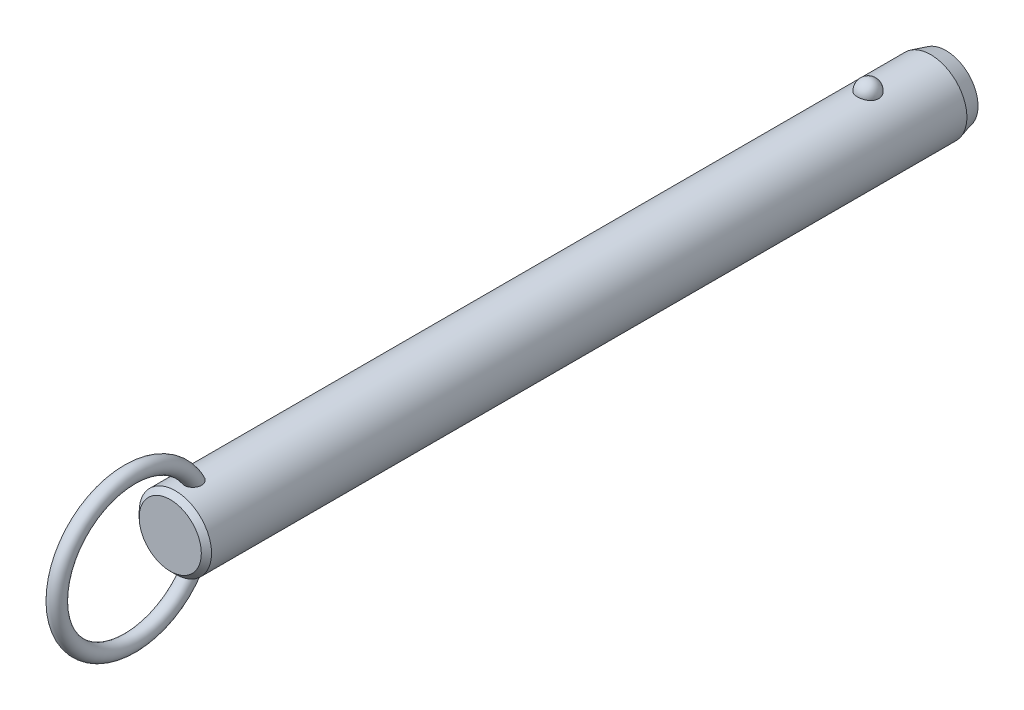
SolidWorks part; units mm, degrees
ref_plane "Front Plane" through (0, 0, 0) normal (0, 0, 1) x (1, 0, 0)
ref_plane "Top Plane" through (0, 0, 0) normal (0, 1, 0) x (1, 0, 0)
ref_plane "Right Plane" through (0, 0, 0) normal (1, 0, 0) x (0, 0, -1)
sketch "Sketch2" plane through (0, 0, 0) normal (0, 0, 1) x (1, 0, 0)
  circle A0 centre (0, 0) radius 7.1
  point P3 (0, 7.1)
  dimension "D1" = 14.2
extrude "Boss-Extrude1" add sketch "Sketch2" along normal blind 127
sketch "Sketch3" plane through (0, 0, 0) normal (0, 0, -1) x (-1, 0, 0)
  circle A0 centre (0, 0) radius 7.1
  dimension "D1" = 14.2
extrude "Boss-Extrude2" add sketch "Sketch3" along normal blind 17.4
chamfer "Chamfer1" distance 3 angle 15 1 edges at (-7.1, 0, -17.4)
sketch "Sketch12" plane through (0, 0, 0) normal (1, 0, 0) x (0, 0, -1)
  line L0 (-127, 7.1) -> (-127, -7.1) construction
  point P0 (-127, 0)
sketch "Sketch13" plane through (0, 0, 0) normal (1, 0, 0) x (0, 0, -1)
  circle A0 centre (-142.85, 0) radius 15.85
  point P2 (-127, 0)
  dimension "D1" = 31.7
sketch "Sketch14" plane through (0, 0, 0) normal (0, 1, 0) x (1, 0, 0)
  circle A0 centre (0, -128.5) radius 1.5
  point P2 (0, -127)
  dimension "D1" = 3
sweep "Sweep1" add profiles "Sketch14" path "Sketch13"
sketch "Sketch15" plane through (0, 0, 127) normal (0, 0, 1) x (1, 0, 0)
  circle A0 centre (0, 0) radius 7.1
  dimension "D1" = 14.2
extrude "Boss-Extrude3" add sketch "Sketch15" along normal blind 7.92
chamfer "Chamfer2" distance 1 angle 45 1 edges at (7.1, 0, 134.92)
sketch "Sketch18" plane through (0, 0, 0) normal (1, 0, 0) x (0, 0, -1)
  line L0 (14.4, 7.1) -> (-128.6792, 7.1) construction
  line L1 (2.1, 9.2) -> (2.1, 5)
  line L2 (-128.6792, -7.1) -> (14.4, -7.1) construction
  arc A0 (2.1, 9.2) -> (2.1, 5) centre (2.1, 7.1) ccw
  point P4 (0, 7.1)
  dimension "D1" = 16.3
revolve "Revolve1" add sketch "Sketch18" angle 360 about L1
